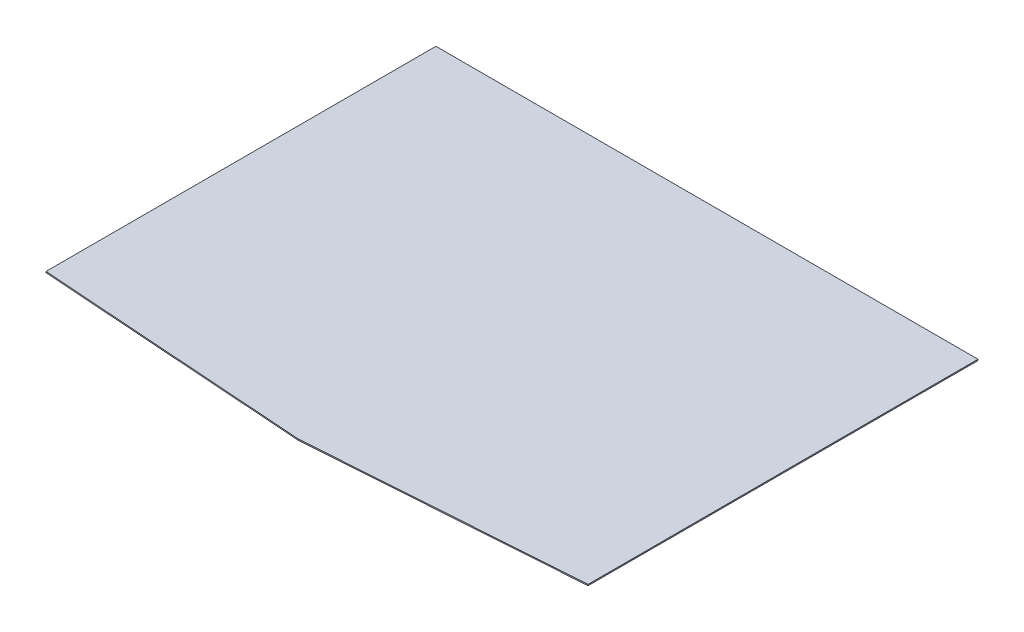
SolidWorks part; units mm, degrees
ref_plane "Front Plane" through (0, 0, 0) normal (0, 0, 1) x (1, 0, 0)
ref_plane "Top Plane" through (0, 0, 0) normal (0, 1, 0) x (1, 0, 0)
ref_plane "Right Plane" through (0, 0, 0) normal (1, 0, 0) x (0, 0, -1)
sketch "Sketch1" plane through (0, 0, 0) normal (0, 1, 0) x (1, 0, 0)
  line L1 (-1111.25, 838.2) -> (1111.25, 838.2)
  line L2 (-1111.25, 838.2) -> (-1111.25, -838.2)
  line L3 (-1111.25, -838.2) -> (1111.25, -838.2)
  line L4 (1111.25, 838.2) -> (1111.25, -838.2)
  line L5 (-1111.25, 838.2) -> (1111.25, -838.2) construction
  line L6 (-1111.25, -838.2) -> (1111.25, 838.2) construction
  point P0 (0, 0)
  dimension "D1" = 2222.5
  dimension "D2" = 1676.4
sheet metal parameters "Sheet-Metal1" thickness 4.7625 parameters "D1"=12.7
base flange "Base-Flange1" sketch "Sketch1" thickness 4.7625 reverse thickness direction no parameters "D1"=12.7
sketch "Sketch2" plane through (0, 0, 0) normal (0, 1, 0) x (1, 0, 0)
  line L0 (0, 0) -> (0, -838.2) construction
  line L1 (-1111.25, -838.2) -> (1111.25, -838.2) construction
  line L2 (0, -838.2) -> (-1111.25, -760.4938)
  line L3 (-1111.25, 838.2) -> (-1111.25, -838.2) construction
  line L4 (-1111.25, -760.4938) -> (-1322.034, -760.4938)
  line L5 (-1322.034, -760.4938) -> (-1322.034, -1137.6717)
  line L6 (-1322.034, -1137.6717) -> (1635.5484, -1137.6717)
  line L7 (1635.5484, -1137.6717) -> (1614.3763, -760.4938)
  line L8 (1614.3763, -760.4938) -> (1111.25, -760.4938)
  line L9 (1111.25, -838.2) -> (1111.25, 838.2) construction
  line L10 (1111.25, -760.4938) -> (0, -838.2)
  dimension "D1" = 4
  dimension "4.5" = 4
extrude "Cut-Extrude1" cut sketch "Sketch2" against normal through all
flat pattern "Flat-Pattern1"
sketch "Bend-Lines1" plane through (0, 0, 0) normal (0, 1, 0) x (-1, 0, 0)
